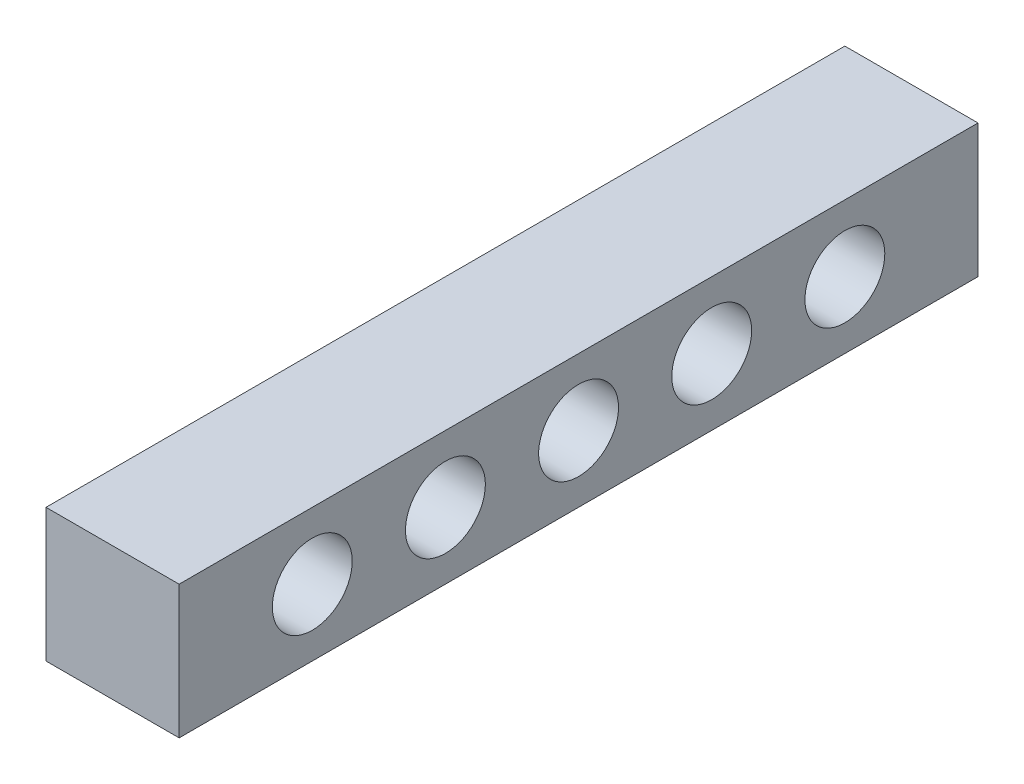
SolidWorks part; units mm, degrees
ref_plane "Front Plane" through (0, 0, 0) normal (0, 0, 1) x (1, 0, 0)
ref_plane "Top Plane" through (0, 0, 0) normal (0, 1, 0) x (1, 0, 0)
ref_plane "Right Plane" through (0, 0, 0) normal (1, 0, 0) x (0, 0, -1)
sketch "Sketch1" plane through (0, 0, 0) normal (1, 0, 0) x (0, 0, -1)
  line L1 (-30, -5) -> (30, -5)
  line L2 (-30, -5) -> (-30, 5)
  line L3 (-30, 5) -> (30, 5)
  line L4 (30, -5) -> (30, 5)
  line L5 (-30, -5) -> (30, 5) construction
  line L6 (-30, 5) -> (30, -5) construction
  point P0 (0, 0)
  dimension "D1" = 60
  dimension "D2" = 10
extrude "Boss-Extrude2" add sketch "Sketch1" along normal blind 10
sketch "Sketch3" plane through (10, 0, 0) normal (1, 0, 0) x (0, 0, -1)
  line L0 (0, 0) -> (-10, 0) construction
  line L1 (-10, 0) -> (-20, 0) construction
  line L2 (0, 0) -> (30, 0) construction
  line L3 (30, -5) -> (30, 5) construction
  circle A0 centre (0, 0) radius 3
  circle A1 centre (-10, 0) radius 3
  circle A2 centre (-20, 0) radius 3
  circle A3 centre (10, 0) radius 3
  circle A4 centre (20, 0) radius 3
  dimension "D1" = 6
  dimension "D3" = 6
  dimension "D5" = 6
  dimension "D6" = 6
  dimension "D7" = 6
  dimension "D2" = 10
  dimension "D4" = 10
  dimension "D8" = 20
  dimension "D9" = 10
extrude "Cut-Extrude1" cut sketch "Sketch3" against normal through all contours A4 | A3 | A0 | A1 | A2
